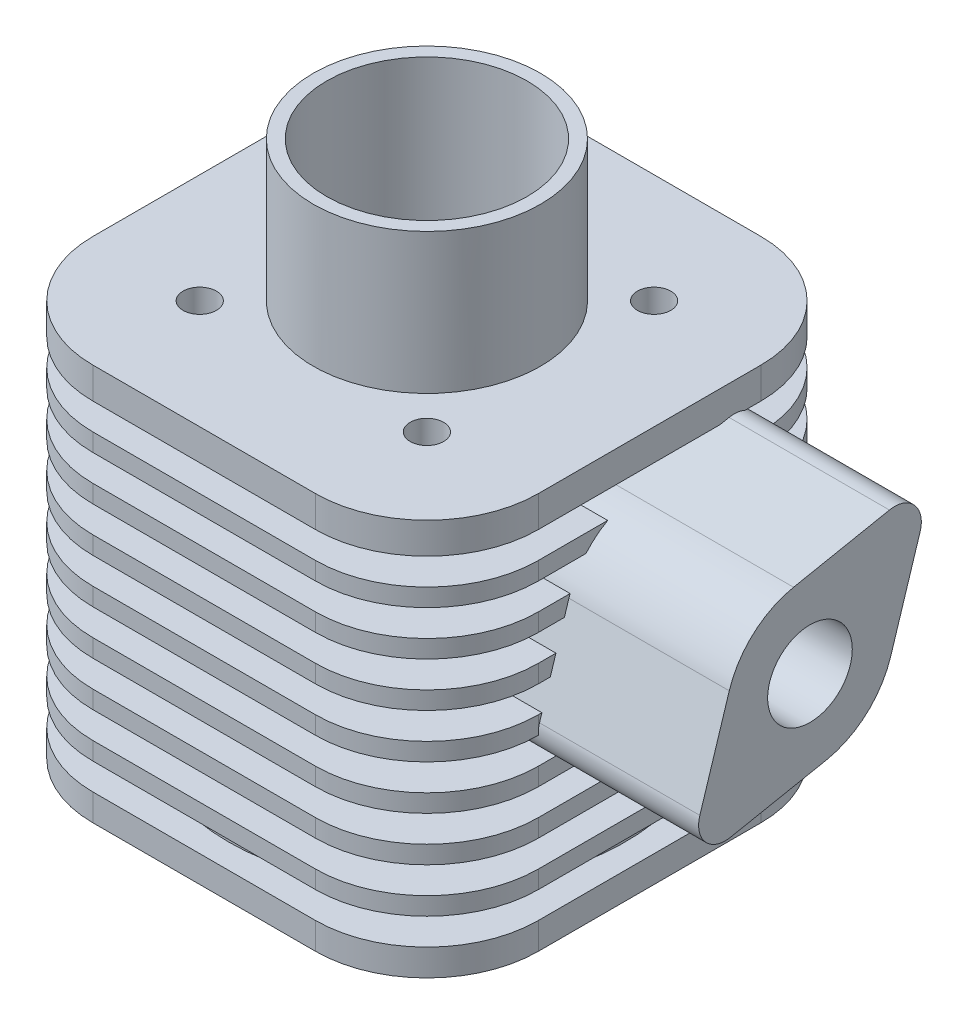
SolidWorks part; units mm, degrees
ref_plane "Front Plane" through (0, 0, 0) normal (0, 0, 1) x (1, 0, 0)
ref_plane "Top Plane" through (0, 0, 0) normal (0, 1, 0) x (1, 0, 0)
ref_plane "Right Plane" through (0, 0, 0) normal (1, 0, 0) x (0, 0, -1)
sketch "Sketch1" plane through (0, 0, 0) normal (0, 1, 0) x (1, 0, 0)
  line L1 (-50, 100) -> (50, 100)
  line L2 (-100, 50) -> (-100, -50)
  line L3 (-50, -100) -> (50, -100)
  line L4 (100, 50) -> (100, -50)
  line L5 (-100, 100) -> (100, -100) construction
  line L6 (-100, -100) -> (100, 100) construction
  arc A0 (-100, -50) -> (-50, -100) centre (-50, -50) ccw
  arc A1 (50, -100) -> (100, -50) centre (50, -50) ccw
  arc A2 (50, 100) -> (100, 50) centre (50, 50) cw
  arc A3 (-50, 100) -> (-100, 50) centre (-50, 50) ccw
  point P0 (0, 0)
  dimension "D3" = 50
  dimension "D1" = 200
  dimension "D2" = 200
extrude "Boss-Extrude1" add sketch "Sketch1" along normal blind 114 and the other way blind 64 contours A3 L2 A0 L3 A1 L4 A2 L1
sketch "Sketch2" plane through (0, 114, 0) normal (0, 1, 0) x (1, 0, 0)
  circle A0 centre (0, 0) radius 45
  dimension "D1" = 90
extrude "Cut-Extrude1" cut sketch "Sketch2" against normal through all contours A0
sketch "Sketch3" plane through (0, 114, 0) normal (0, 1, 0) x (1, 0, 0)
  circle A0 centre (0, 0) radius 51
  circle A1 centre (0, 0) radius 45
  dimension "D1" = 102
  dimension "D2" = 90
extrude "Boss-Extrude2" add sketch "Sketch3" along normal blind 63 contours A0 M1
sketch "Sketch6" plane through (0, 0, 0) normal (0, 0, 1) x (1, 0, 0)
  line L0 (0, 0) -> (0, -97.8873) construction
  line L1 (89, -40) -> (127, -40)
  line L2 (89, -40) -> (89, -52)
  line L3 (89, -52) -> (127, -52)
  line L4 (127, -40) -> (127, -52)
  line L5 (0, -110) -> (0, 110) construction
  line L6 (50, -64) -> (100, -64) construction
  dimension "D1" = 38
  dimension "D2" = 12
  dimension "D3" = 178
  dimension "D4" = 12
revolve "Cut-Revolve1" cut sketch "Sketch6" angle 360 about L0
sketch "Sketch7" plane through (0, 0, 0) normal (0, 0, 1) x (1, 0, 0)
  line L0 (0, 0) -> (0, -92.7715) construction
  line L1 (88, -32) -> (126, -32)
  line L2 (88, -32) -> (88, -20)
  line L3 (88, -20) -> (126, -20)
  line L4 (126, -32) -> (126, -20)
  line L5 (0, -110) -> (0, 110) construction
  line L8 (100, -52) -> (50, -52) construction
  dimension "D1" = 38
  dimension "D2" = 88
  dimension "D3" = 20
  dimension "D4" = 12
revolve "Cut-Revolve3" cut sketch "Sketch7" angle 360 about L0
pattern_linear "LPattern2" count 7 spacing 20 along (0, 1, 0) of "Cut-Revolve3"
sketch "Sketch8" plane through (0, -64, 0) normal (0, -1, 0) x (1, 0, 0)
  line L0 (-31.5, 82.4444) -> (31.5, 82.4444) construction
  line L2 (110, 0) -> (-110, 0) construction
  line L3 (0, -110) -> (0, 110) construction
  line L4 (82.4444, -31.5) -> (82.4444, 31.5) construction
  circle A6 centre (0, 0) radius 45
  arc A7 (61.1982, 44.6757) -> (44.6757, 61.1982) centre (51, 51) ccw
  arc A8 (-61.1982, 44.6757) -> (-44.6757, 61.1982) centre (-51, 51) cw
  arc A11 (-61.1982, -44.6757) -> (-44.6757, -61.1982) centre (-51, -51) ccw
  arc A12 (61.1982, -44.6757) -> (44.6757, -61.1982) centre (51, -51) cw
  arc A13 (57.9871, 26.3191) -> (57.9871, -26.3191) centre (-66.2558, 0) cw
  arc A14 (57.9871, 26.3191) -> (61.1982, 44.6757) centre (82.4444, 31.5) cw
  arc A15 (57.9871, -26.3191) -> (61.1982, -44.6757) centre (82.4444, -31.5) ccw
  circle A17 centre (51, 51) radius 7.5
  circle A18 centre (-51, 51) radius 7.5
  circle A19 centre (-51, -51) radius 7.5
  circle A20 centre (51, -51) radius 7.5
  arc A21 (-57.9871, -26.3191) -> (-61.1982, -44.6757) centre (-82.4444, -31.5) cw
  arc A22 (-57.9871, 26.3191) -> (-57.9871, -26.3191) centre (66.2558, 0) ccw
  arc A23 (-57.9871, 26.3191) -> (-61.1982, 44.6757) centre (-82.4444, 31.5) ccw
  arc A24 (26.3191, 57.9871) -> (-26.3191, 57.9871) centre (0, -66.2558) ccw
  arc A25 (-26.3191, 57.9871) -> (-44.6757, 61.1982) centre (-31.5, 82.4444) cw
  arc A26 (26.3191, 57.9871) -> (44.6757, 61.1982) centre (31.5, 82.4444) ccw
  arc A28 (26.3191, -57.9871) -> (44.6757, -61.1982) centre (31.5, -82.4444) cw
  arc A29 (26.3191, -57.9871) -> (-26.3191, -57.9871) centre (0, 66.2558) cw
  arc A30 (-26.3191, -57.9871) -> (-44.6757, -61.1982) centre (-31.5, -82.4444) ccw
  dimension "D1" = 90
  dimension "D2" = 24
  dimension "D11" = 63
  dimension "D6" = 25
  dimension "D7" = 127
  dimension "D8" = 15
  dimension "D9" = 127
  dimension "D10" = 25
  dimension "D3" = 51
  dimension "D4" = 51
  dimension "D5" = 63
extrude "Boss-Extrude3" add sketch "Sketch8" along normal blind 6.5 contours A30 A29 A28 A12 A15 A13 A14 A7 A26 A24 A25 A8 A23 A22 A21 A11 A20 A19 A18 A17 M13 | A6
sketch "Sketch9" plane through (0, -70.5, 0) normal (0, -1, 0) x (1, 0, 0)
  circle A0 centre (-51, 51) radius 7.5 construction
  circle A1 centre (-51, -51) radius 7.5 construction
  circle A2 centre (51, -51) radius 7.5 construction
  circle A3 centre (51, 51) radius 7.5 construction
  circle A4 centre (-51, 51) radius 7.5
  circle A5 centre (-51, -51) radius 7.5
  circle A6 centre (51, -51) radius 7.5
  circle A7 centre (51, 51) radius 7.5
extrude "Cut-Extrude2" cut sketch "Sketch9" against normal through all
ref_plane "Plane1" through (172, 0, 0) normal (1, 0, 0) x (0, 0, -1)
sketch "Sketch10" plane through (172, 0, 0) normal (1, 0, 0) x (0, 0, -1)
  line L0 (0, 110) -> (0, -110) construction
  line L1 (45, 177) -> (-45, 177) construction
  line L2 (38, 89.0147) -> (-38, 20.9853) construction
  line L9 (35.6729, 100.7869) -> (-7.369, 92.2787)
  line L10 (-36.2379, 66.4374) -> (-49.4435, 24.5971)
  line L11 (-35.6729, 9.2131) -> (7.369, 17.7213)
  line L12 (36.2379, 43.5626) -> (49.4435, 85.4029)
  circle A0 centre (0, 55) radius 19
  arc A1 (7.369, 17.7213) -> (36.2379, 43.5626) centre (0, 55) ccw
  arc A2 (49.4435, 85.4029) -> (35.6729, 100.7869) centre (38, 89.0147) ccw
  arc A3 (-49.4435, 24.5971) -> (-35.6729, 9.2131) centre (-38, 20.9853) ccw
  arc A4 (-7.369, 92.2787) -> (-36.2379, 66.4374) centre (0, 55) ccw
  dimension "D1" = 38
  dimension "D2" = 76
  dimension "D4" = 24
  dimension "D5" = 24
  dimension "D3" = 122
  dimension "D6" = 102
  dimension "D7" = 51
  dimension "D8" = 76
extrude "Boss-Extrude4" add sketch "Sketch10" against normal up to surface (86.0756 mm away)
sketch "Sketch11" plane through (172, 0, 0) normal (1, 0, 0) x (0, 0, -1)
  circle A0 centre (0, 55) radius 19 construction
  circle A1 centre (0, 55) radius 19
extrude "Cut-Extrude3" cut sketch "Sketch11" against normal up to surface (131.2078 mm away)
